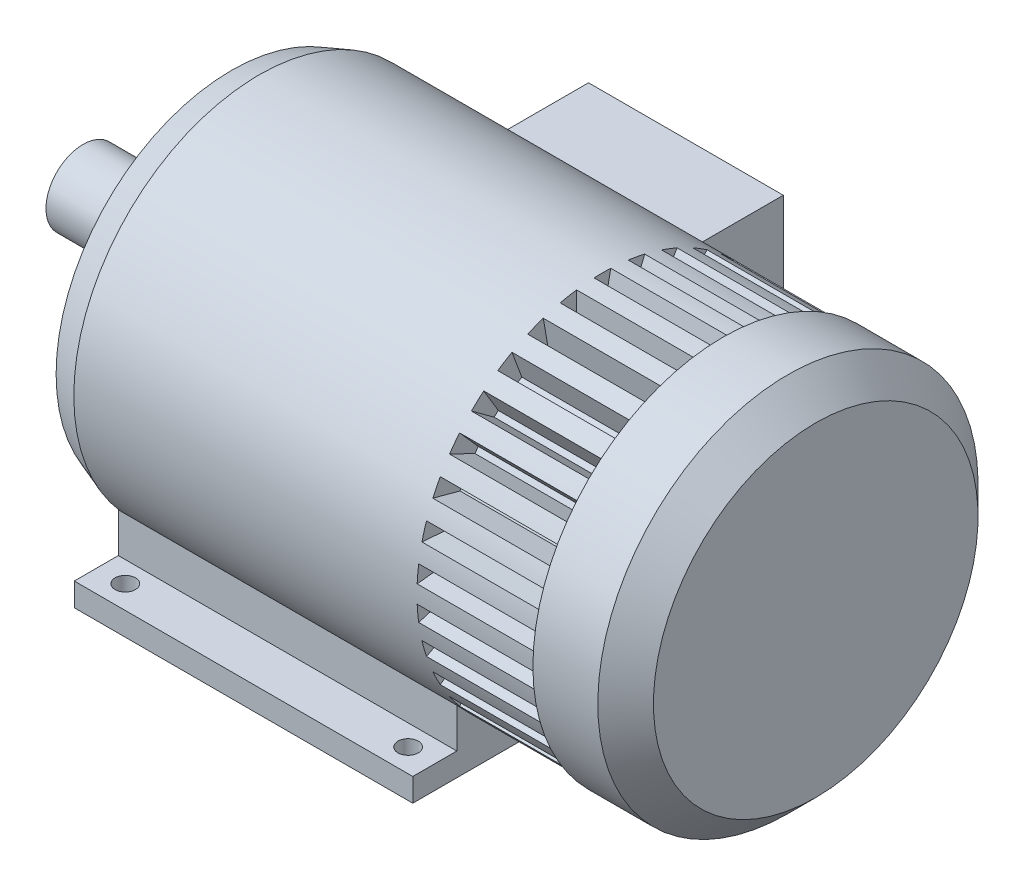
SolidWorks part; units mm, degrees
ref_plane "Front Plane" through (0, 0, 0) normal (0, 0, 1) x (1, 0, 0)
ref_plane "Top Plane" through (0, 0, 0) normal (0, 1, 0) x (1, 0, 0)
ref_plane "Right Plane" through (0, 0, 0) normal (1, 0, 0) x (0, 0, -1)
sketch "Sketch1" plane through (0, 0, 0) normal (0, 0, 1) x (1, 0, 0)
  line L0 (-690, 0) -> (-690, 40)
  line L1 (-690, 40) -> (-540, 40)
  line L2 (-540, 40) -> (-540, 80)
  line L3 (-540, 80) -> (-530, 80)
  line L4 (-530, 80) -> (-530, 189.0809)
  line L5 (-530, 189.0809) -> (-500, 200)
  line L6 (-500, 200) -> (0, 200)
  line L7 (0, 200) -> (0, 0)
  line L13 (0, 0) -> (-690, 0)
  dimension "D1" = 690
  dimension "D2" = 40
  dimension "D3" = 150
  dimension "D4" = 10
  dimension "D5" = 30
  dimension "D6" = 200
  dimension "D7" = 80
  dimension "D8" = 160
revolve "Revolve1" add sketch "Sketch1" angle 360 about L13
sketch "Sketch5" plane through (0, 0, 0) normal (0, 0, 1) x (1, 0, 0)
  line L1 (-502, -200) -> (-137, -200)
  line L2 (-502, -200) -> (-502, -175)
  line L3 (-502, -175) -> (-137, -175)
  line L4 (-137, -200) -> (-137, -175)
  dimension "D1" = 365
  dimension "D2" = 200
  dimension "D3" = 25
  dimension "D4" = 188
extrude "Boss-Extrude1" add sketch "Sketch5" along normal mid plane 395 contours L3 L4 L1 L2
sketch "Sketch6" plane through (-502, 0, 0) normal (-1, 0, 0) x (0, 0, 1)
  line L0 (-95.3119, -175) -> (-197.5, -175) construction
  line L1 (-150, -175) -> (150, -175)
  line L2 (-150, -175) -> (-150, -132.2876)
  line L3 (-150, -132.2876) -> (150, -132.2876)
  line L4 (150, -175) -> (150, -132.2876)
  circle A0 centre (0, 0) radius 200 construction
  dimension "D1" = 300
extrude "Boss-Extrude2" add sketch "Sketch6" against normal blind 365
ref_plane "Plane1" through (-50, 0, 0) normal (1, 0, 0) x (0, 0, -1)
sketch "Sketch7" plane through (0, 0, 0) normal (1, 0, 0) x (0, 0, -1)
  line L0 (0, 0) -> (0, 170) construction
  line L1 (-3, 170) -> (3, 170)
  line L2 (-3, 170) -> (-9, 199.7974)
  line L4 (3, 170) -> (9, 199.7974)
  line L5 (0, 170) -> (0, 200) construction
  circle A0 centre (0, 0) radius 200 construction
  arc A1 (-9, 199.7974) -> (9, 199.7974) centre (0, 0) cw
  dimension "D2" = 18
  dimension "D1" = 6
  dimension "D3" = 30
extrude "Cut-Extrude3" cut sketch "Sketch7" against normal blind 130 contours A1 L4 L1 L2
pattern_circular "CirPattern1" count 34 over 360 about axis through (0, 0, 0) along (1, 0, 0) of "Cut-Extrude3"
sketch "Sketch8" plane through (0, 0, 0) normal (1, 0, 0) x (0, 0, -1)
  circle A0 centre (0, 0) radius 205
  dimension "D1" = 410
extrude "Boss-Extrude3" add sketch "Sketch8" along normal blind 100
chamfer "Chamfer1" distance 30 angle 45 1 edges at (100, 205, 0)
sketch "Sketch9" plane through (0, -175, 0) normal (0, 1, 0) x (1, 0, 0)
  line L0 (-472, -172.5) -> (-167, -172.5) construction
  line L1 (-502, -197.5) -> (-137, -197.5) construction
  line L2 (-319.5, -172.5) -> (-319.5, -197.5) construction
  circle A0 centre (-472, -172.5) radius 11
  circle A1 centre (-167, -172.5) radius 11
  dimension "D1" = 305
  dimension "D2" = 22
  dimension "D3" = 25
extrude "Cut-Extrude4" cut sketch "Sketch9" against normal through all
mirror "Mirror1" about plane through (0, 0, 0) normal (0, 0, 1) of "Cut-Extrude4"
sketch "Sketch11" plane through (0, 0, 0) normal (0, 0, 1) x (1, 0, 0)
  line L0 (0, 0) -> (-330, 0) construction
  line L1 (-435, -80) -> (-225, -80)
  line L2 (-435, -80) -> (-435, 80)
  line L3 (-435, 80) -> (-225, 80)
  line L4 (-225, -80) -> (-225, 80)
  line L5 (-435, -80) -> (-225, 80) construction
  line L6 (-435, 80) -> (-225, -80) construction
  point P0 (-330, 0)
  dimension "D1" = 210
  dimension "D2" = 160
  dimension "D3" = 330
extrude "Boss-Extrude4" add sketch "Sketch11" against normal blind 290
